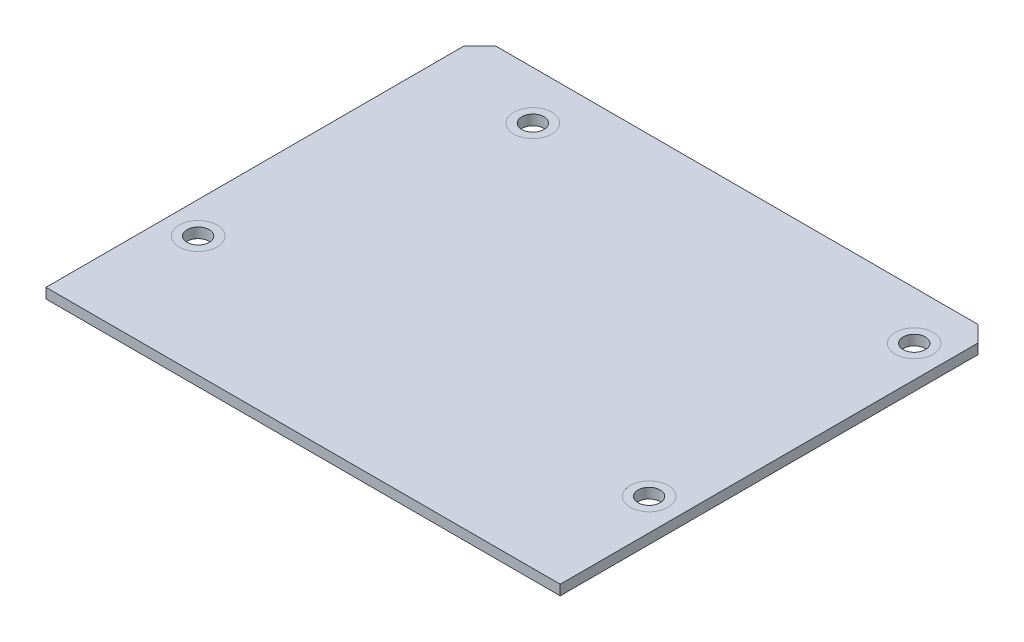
SolidWorks part; units mm, degrees
ref_plane "Front Plane" through (0, 0, 0) normal (0, 0, 1) x (1, 0, 0)
ref_plane "Top Plane" through (0, 0, 0) normal (0, 1, 0) x (1, 0, 0)
ref_plane "Right Plane" through (0, 0, 0) normal (1, 0, 0) x (0, 0, -1)
sketch "Sketch1" plane through (0, 0, 0) normal (0, 1, 0) x (1, 0, 0)
  line L1 (-40.64, 34.29) -> (40.64, 34.29)
  line L2 (-40.64, 34.29) -> (-40.64, -34.29)
  line L3 (-40.64, -34.29) -> (40.64, -34.29)
  line L4 (40.64, 34.29) -> (40.64, -34.29)
  line L5 (-40.64, 34.29) -> (40.64, -34.29) construction
  line L6 (-40.64, -34.29) -> (40.64, 34.29) construction
  point P0 (0, 0)
  dimension "D1" = 81.28
  dimension "D2" = 68.58
extrude "Boss-Extrude1" add sketch "Sketch1" along normal blind 1.6
chamfer "Chamfer1" distance 2.54 angle 45 2 edges at (40.64, 0.8, -34.29) (-40.64, 0.8, -34.29)
sketch "Sketch2" plane through (0, 1.6, 0) normal (0, 1, 0) x (1, 0, 0)
  line L0 (-40.64, 31.75) -> (-40.64, -34.29) construction
  line L1 (-40.64, -34.29) -> (40.64, -34.29) construction
  line L2 (40.64, -34.29) -> (40.64, 31.75) construction
  circle A0 centre (-24.64, 26.67) radius 1.75
  circle A1 centre (35.64, 26.67) radius 1.75
  circle A2 centre (35.64, -15.24) radius 1.75
  circle A3 centre (-35.64, -15.24) radius 1.75
  dimension "D1" = 3.5
  dimension "D2" = 3.5
  dimension "D3" = 3.5
  dimension "D4" = 3.5
  dimension "D6" = 5
  dimension "D9" = 5
  dimension "D5" = 16
  dimension "D7" = 60.96
  dimension "D8" = 19.05
extrude "Cut-Extrude1" cut sketch "Sketch2" against normal up to next
sketch "Sketch3" plane through (0, 1.6, 0) normal (0, 1, 0) x (1, 0, 0)
  circle A0 centre (-24.64, 26.67) radius 3
  circle A1 centre (35.64, 26.67) radius 3
  circle A2 centre (-35.64, -15.24) radius 3
  circle A3 centre (35.64, -15.24) radius 3
  dimension "D1" = 6
extrude "Cut-Extrude2" cut sketch "Sketch3" against normal blind 0.0001
